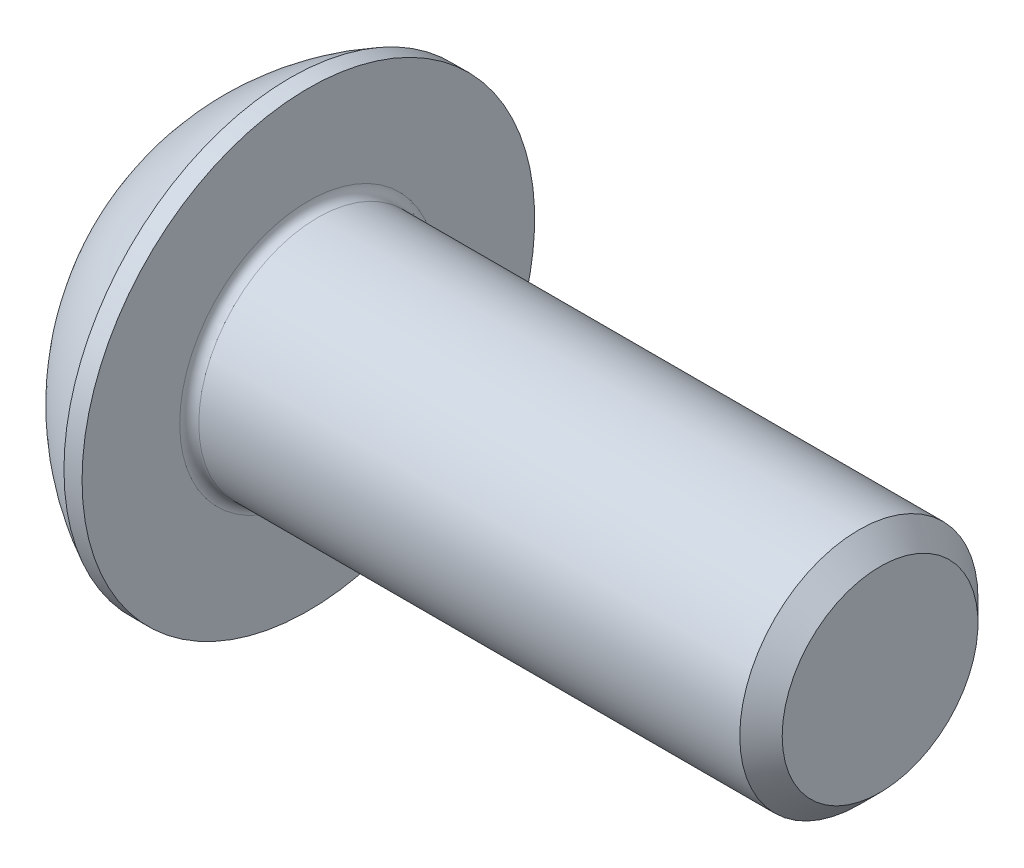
SolidWorks part; units mm, degrees
ref_plane "Plane1" through (0, 0, 0) normal (0, 0, 1) x (1, 0, 0)
ref_plane "Plane2" through (0, 0, 0) normal (0, 1, 0) x (1, 0, 0)
ref_plane "Plane3" through (0, 0, 0) normal (1, 0, 0) x (0, 0, -1)
other "Configuration Table"
sketch "BodySke" plane through (0, 0, 0) normal (0, 0, 1) x (1, 0, 0)
  line L0 (14.75, 0) -> (14.75, 2.055)
  line L1 (14.305, 2.5) -> (2.75, 2.5)
  line L2 (2.75, 2.5) -> (2.75, 4.75)
  line L3 (2.75, 4.75) -> (2.37, 4.75)
  line L4 (0, 0) -> (101.6, 0) construction
  line L5 (2.75, -4.75) -> (2.37, -4.75) construction
  line L6 (55.6768, -2.5) -> (2.75, -2.5) construction
  line L7 (14.75, 0) -> (0, 0)
  line L8 (0, 2.375) -> (0, -2.375) construction
  line L9 (0, 0) -> (0, 2.375)
  line L10 (14.75, 2.055) -> (14.305, 2.5)
  line L11 (14.75, -2.055) -> (14.305, -2.5) construction
  line L12 (3.55, 9.525) -> (3.55, -2.5) construction
  line L13 (2.75, 9.525) -> (2.75, -2.5) construction
  arc A1 (0, 2.375) -> (2.37, 4.75) centre (4.755, 0) cw
revolve "BaseBody" add sketch "BodySke" angle 360 about L4
fillet "Fillet1" radius 0.2 1 edges at (2.75, 0, 2.5)
sketch "Sketch2" plane through (0, 0, 0) normal (0, 0, 1) x (1, 0, 0)
  line L0 (0, 1.5) -> (1.56, 1.5)
  line L1 (1.56, 1.5) -> (2.426, 0)
  line L3 (2.426, 0) -> (0, 0)
  line L4 (0, 0) -> (0, 1.5)
  line L5 (0, -1.5) -> (1.56, -1.5) construction
  line L6 (0, 0) -> (47.625, 0) construction
  dimension "D2" = 60
  dimension "PreBroach_depth" = 1.56
  dimension "PreBroach_dia" = 3
revolve "PreBroach" cut sketch "Sketch2" angle 360 about L6
sketch "Sketch3" plane through (0, 0, 0) normal (1, 0, 0) x (0, 0, -1)
  line L0 (-1.5, -0.866) -> (-1.5, 0.866)
  line L1 (-1.5, 0.866) -> (0, 1.7321)
  line L2 (0, 1.7321) -> (1.5, 0.866)
  line L3 (1.5, 0.866) -> (1.5, -0.866)
  line L4 (1.5, -0.866) -> (0, -1.7321)
  line L5 (0, -1.7321) -> (-1.5, -0.866)
extrude "Hex" cut sketch "Sketch3" along normal blind 1.56
sketch "ThdSchSke" plane through (0, 0, 0) normal (0, 0, 1) x (1, 0, 0)
  line L0 (4.35, -2.055) -> (4.0384, -2.5)
  line L1 (4.35, -2.055) -> (4.6616, -2.5)
  line L2 (4.6616, -2.5) -> (4.6616, -3.125)
  line L3 (-3.175, 0) -> (5.1513, 0) construction
  line L5 (4.6616, -3.125) -> (4.0384, -3.125)
  line L6 (4.0384, -3.125) -> (4.0384, -2.5)
revolve "ThreadSchematic" [suppressed] cut sketch "ThdSchSke" angle 360 about L3
pattern_linear "ThdSchPat" [suppressed]
equation "\"D1@BodySke\" = \"Head_dia@BodySke\" * .5"
equation "\"Thread_minor@ThreadCosmetic\" = \"Minor_dia@BodySke\""
equation "\"D1@Sketch3\" = \"Hex_size@Sketch3\" / 2"
equation "\"D2@Sketch3\" = \"D1@Sketch3\""
equation "\"D3@Sketch3\" = \"Hex_size@Sketch3\""
equation "\"Thread_length@ThreadCosmetic\" = ((sgn( (\"Length@BodySke\" - \"Advance@BodySke\" * 2.0) - \"Thread_nom@BodySke\" )-1)*( (\"Length@BodySke\" - \"Advance@BodySke\" * 2.0) - \"Thread_nom@BodySke\" ))/-2+ \"Thread_no"
equation "\"Thread_minor@ThdSchSke\" = \"Minor_dia@BodySke\""
equation "\"Diameter@ThdSchSke\" = \"Diameter@BodySke\""
equation "\"Overcut@ThdSchSke\" = \"Diameter@BodySke\" * 1.25"
equation "\"Start@ThdSchSke\" = \"Head_ht@BodySke\" + \"Length@BodySke\" - \"Thread_length@ThreadCosmetic\"  '---Non-countersunk---"
equation "\"Num_threads@ThdSchPat\" = int( \"Thread_length@ThreadCosmetic\" / \"Advance@BodySke\" + 0.999 )  + 1"
equation "\"Advance@ThdSchPat\" = \"Thread_length@ThreadCosmetic\" /  (\"Num_threads@ThdSchPat\" - 1) 'relax it"
equation "\"Num_threads@ThdSchPat\" = \"Num_threads@ThdSchPat\" - sgn( \"Num_threads@ThdSchPat\" - 1) '---chamfered tips only---"
